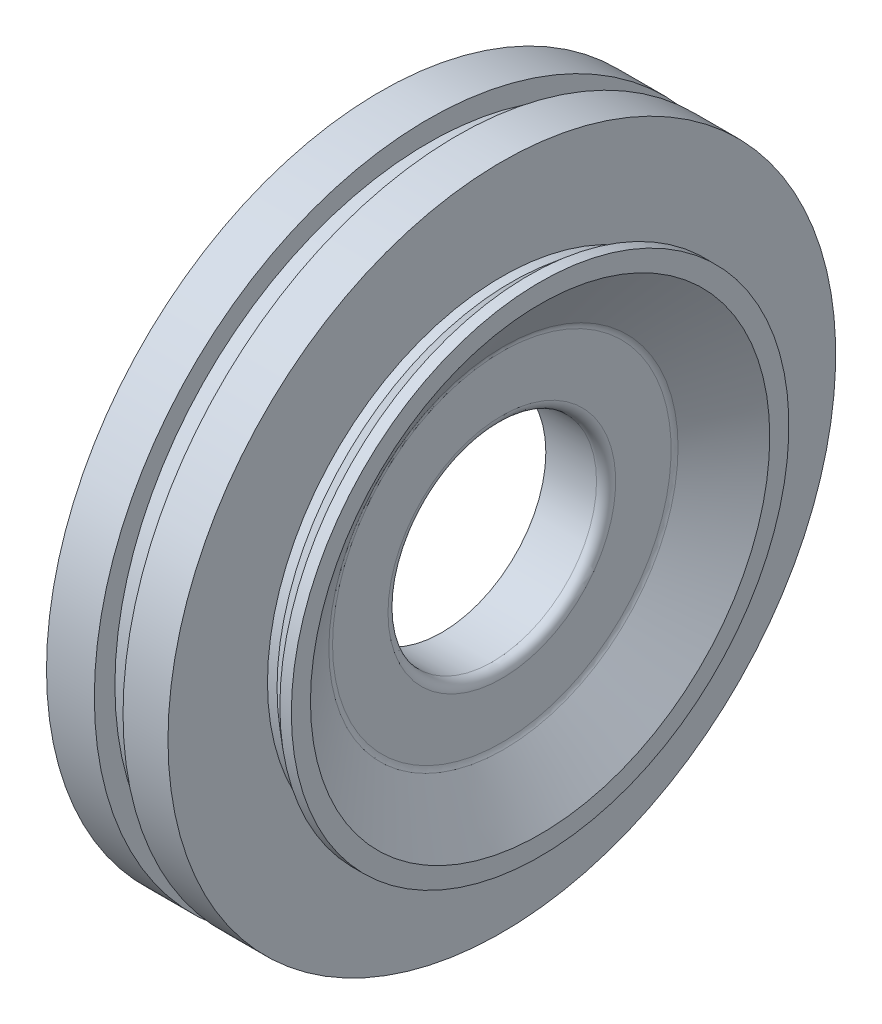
SolidWorks part; units mm, degrees
ref_plane "Front" through (0, 0, 0) normal (0, 0, 1) x (1, 0, 0)
ref_plane "Top" through (0, 0, 0) normal (0, 1, 0) x (1, 0, 0)
ref_plane "Right" through (0, 0, 0) normal (1, 0, 0) x (0, 0, -1)
sketch "Sketch1" plane through (0, 0, 0) normal (0, 0, 1) x (1, 0, 0)
  line L0 (1.2379, 27.566) -> (1.2379, 34.9)
  line L1 (1.2379, 34.9) -> (6.2379, 34.9)
  line L2 (6.2379, 34.9) -> (6.2379, 32.75)
  line L3 (6.2379, 32.75) -> (9.2379, 32.75)
  line L4 (9.2379, 32.75) -> (9.2379, 34.9)
  line L5 (9.2379, 34.9) -> (13.9379, 34.9)
  line L6 (13.9379, 34.9) -> (13.9379, 24.5)
  line L7 (13.9379, 24.5) -> (14.9379, 24.5)
  line L8 (14.9379, 24.5) -> (16.7379, 26.0064)
  line L9 (16.7379, 26.0064) -> (17.9379, 26.0064)
  line L10 (17.9379, 26.0064) -> (17.9379, 24.0064)
  line L11 (17.9379, 24.0064) -> (13.9379, 18)
  line L13 (13.9379, 10.9) -> (13.9379, 18)
  line L14 (13.9379, 10.9) -> (7.6379, 10.9)
  line L15 (0, 0) -> (26.3138, 0) construction
  line L16 (1.7102, 27.0668) -> (8.2091, 26.7052)
  line L17 (10.096, 24.6178) -> (9.7942, 17.9556)
  line L18 (7.2649, 17.1732) -> (9.3677, 17.4835)
  line L19 (6.8379, 16.6785) -> (6.8379, 14.5)
  line L20 (6.8379, 14.5) -> (7.6379, 14.5)
  line L21 (7.6379, 14.5) -> (7.6379, 10.9)
  arc A0 (8.2091, 26.7052) -> (10.096, 24.6178) centre (8.098, 24.7083) cw
  arc A1 (9.3677, 17.4835) -> (9.7942, 17.9556) centre (9.2947, 17.9782) ccw
  arc A2 (1.7102, 27.0668) -> (1.2379, 27.566) centre (1.7379, 27.566) cw
  arc A3 (7.2649, 17.1732) -> (6.8379, 16.6785) centre (7.3379, 16.6785) ccw
  dimension "D13" = 0.5
  dimension "D8" = 2
  dimension "D10" = 0.5
  dimension "D1" = 12.7
  dimension "D2" = 3
  dimension "D3" = 5
  dimension "D4" = 10.9
  dimension "D5" = 4
  dimension "D6" = 2
  dimension "D7" = 1.2
  dimension "D9" = 5.6
  dimension "D11" = 14.5
  dimension "D12" = 0.8
  dimension "D14" = 24.5
  dimension "D15" = 1
  dimension "D16" = 18
  dimension "D17" = 34.9
  dimension "D18" = 34.9
  dimension "D19" = 32.75
revolve "Revolve1" add sketch "Sketch1" angle 360 about L15
fillet "Fillet1" radius 1 2 edges at (13.9379, 0, 10.9) (13.9379, 0, 18)
